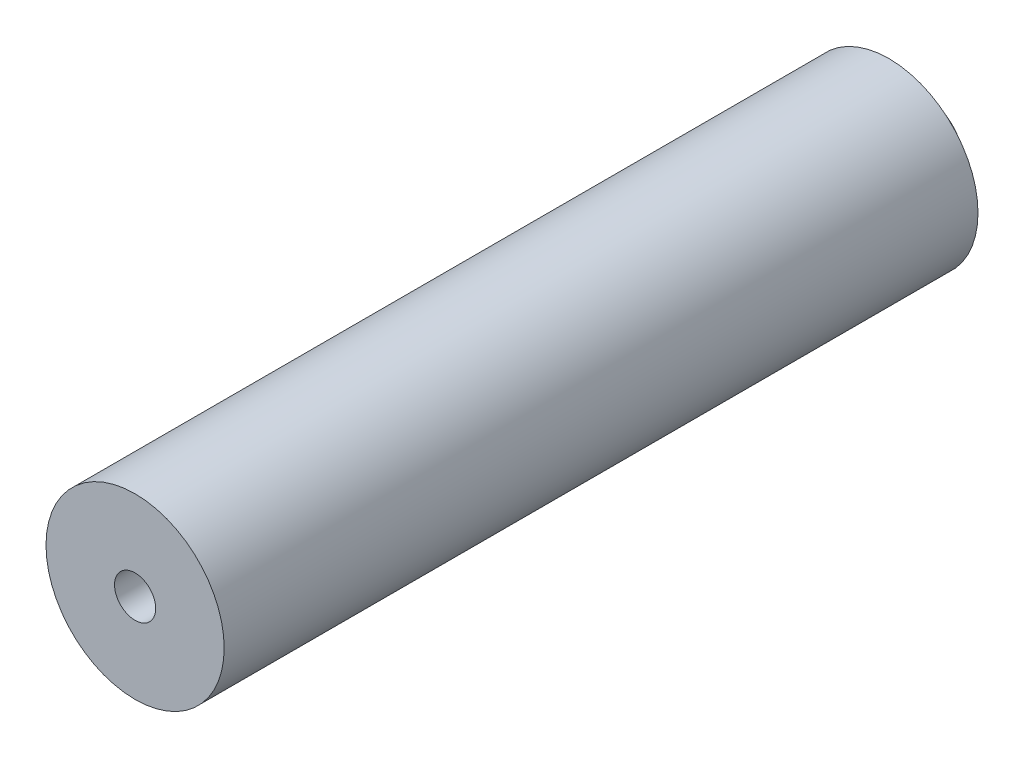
SolidWorks part; units mm, degrees
ref_plane "Plan de face" through (0, 0, 0) normal (0, 0, 1) x (1, 0, 0)
ref_plane "Plan de dessus" through (0, 0, 0) normal (0, 1, 0) x (1, 0, 0)
ref_plane "Plan de droite" through (0, 0, 0) normal (1, 0, 0) x (0, 0, -1)
sketch "Esquisse1" plane through (0, 0, 0) normal (0, 0, 1) x (1, 0, 0)
  circle A0 centre (0, 0) radius 6.5
  dimension "D1" = 13
extrude "Boss.-Extru.1" add sketch "Esquisse1" along normal blind 55
sketch "Esquisse2" plane through (0, 0, 0) normal (0, 0, -1) x (-1, 0, 0)
  circle A0 centre (0, 0) radius 3
  dimension "D1" = 6
extrude "Boss.-Extru.2" add sketch "Esquisse2" along normal blind 2.5
sketch "Esquisse3" plane through (0, 0, -2.5) normal (0, 0, -1) x (-1, 0, 0)
  circle A0 centre (0, 0) radius 1.5
  dimension "D1" = 3
extrude "Enlèv. mat.-Extru.1" cut sketch "Esquisse3" against normal through all
